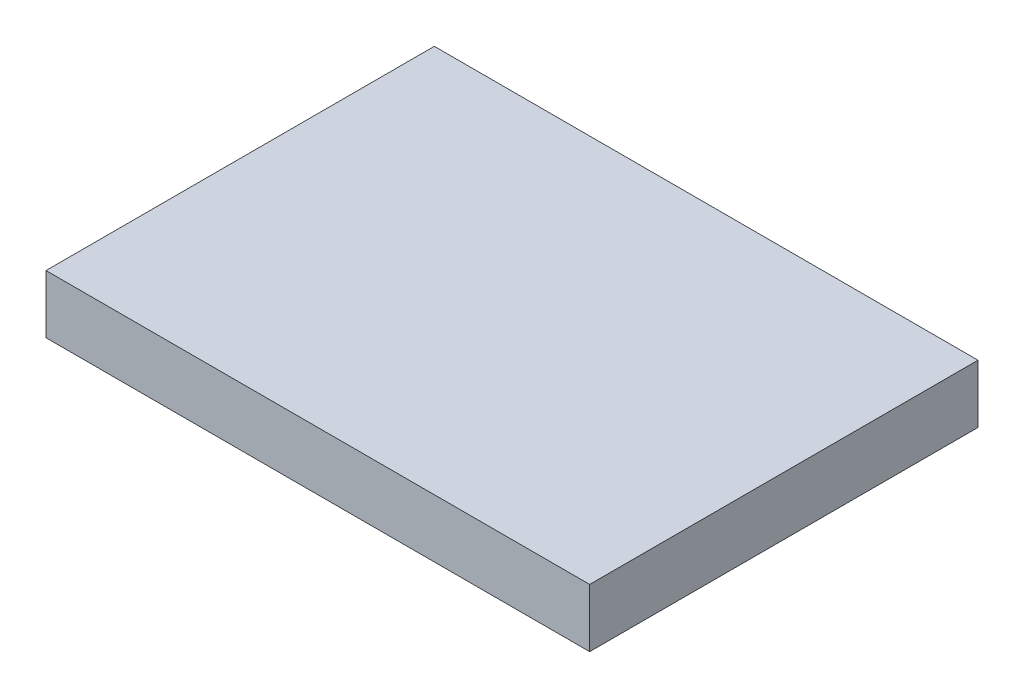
SolidWorks part; units mm, degrees
ref_plane "FRONT" through (0, 0, 0) normal (0, 0, 1) x (1, 0, 0)
ref_plane "TOP" through (0, 0, 0) normal (0, 1, 0) x (1, 0, 0)
ref_plane "RIGHT" through (0, 0, 0) normal (1, 0, 0) x (0, 0, -1)
sketch "Sketch1" plane through (0, 0, 0) normal (0, 1, 0) x (1, 0, 0)
  line L1 (-22.225, 15.875) -> (22.225, 15.875)
  line L2 (-22.225, 15.875) -> (-22.225, -15.875)
  line L3 (-22.225, -15.875) -> (22.225, -15.875)
  line L4 (22.225, 15.875) -> (22.225, -15.875)
  line L5 (-22.225, 15.875) -> (22.225, -15.875) construction
  line L6 (-22.225, -15.875) -> (22.225, 15.875) construction
  point P0 (0, 0)
  dimension "D1" = 31.75
  dimension "D2" = 44.45
extrude "Boss-Extrude1" add sketch "Sketch1" against normal blind 4.7625
